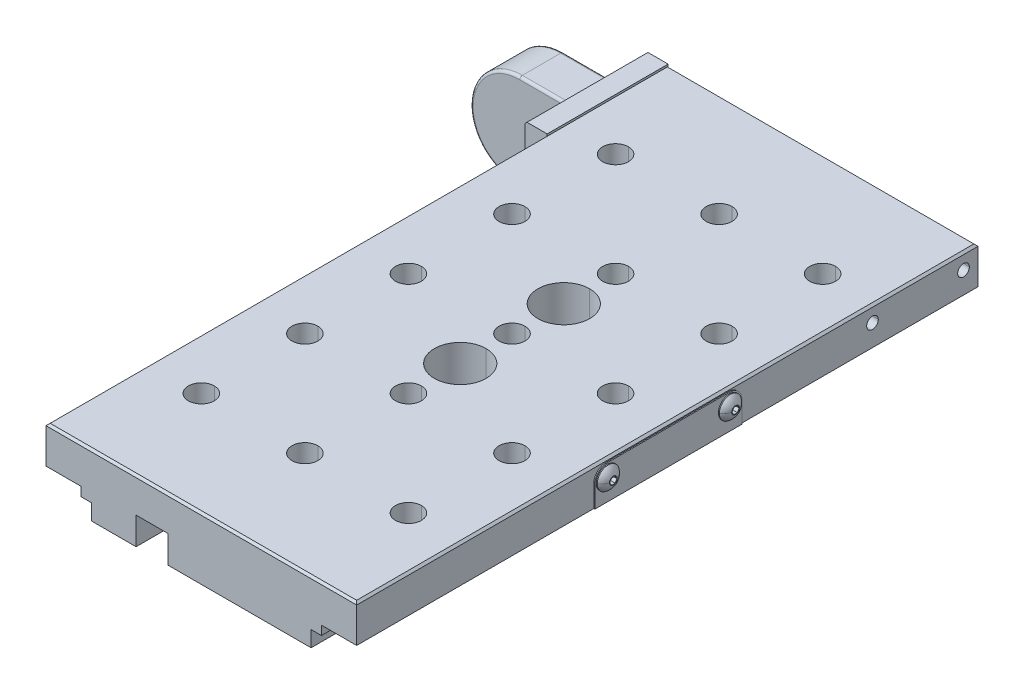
SolidWorks part; units mm, degrees
ref_plane "Plan de face" through (0, 0, 0) normal (0, 0, 1) x (1, 0, 0)
ref_plane "Plan de dessus" through (0, 0, 0) normal (0, 1, 0) x (1, 0, 0)
ref_plane "Plan de droite" through (0, 0, 0) normal (1, 0, 0) x (0, 0, -1)
imported_body "Newport-443 mobile.STEP"
sketch "Esquisse1" plane through (0, 0, 152.4) normal (0, 0, 1) x (1, 0, 0)
  line L1 (-26.924, 9.8186) -> (28.0331, 9.8186)
  line L2 (-26.924, 9.8186) -> (-26.924, 10.2186)
  line L3 (-26.924, 10.2186) -> (28.0331, 10.2186)
  line L4 (28.0331, 9.8186) -> (28.0331, 10.2186)
  dimension "D1" = 0.4
extrude "Enlèv. mat.-Extru.1" cut sketch "Esquisse1" against normal through all
sketch "Esquisse2" plane through (0, 0, 152.4) normal (0, 0, 1) x (1, 0, 0)
  line L1 (-29.464, 15.9004) -> (-39.1704, 15.9004)
  line L2 (-29.464, 15.9004) -> (-29.464, 16.3004)
  line L3 (-29.464, 16.3004) -> (-39.1704, 16.3004)
  line L4 (-39.1704, 15.9004) -> (-39.1704, 16.3004)
  line L5 (29.464, 15.9004) -> (39.7014, 15.9004)
  line L6 (29.464, 15.9004) -> (29.464, 16.3004)
  line L7 (29.464, 16.3004) -> (39.7014, 16.3004)
  line L8 (39.7014, 15.9004) -> (39.7014, 16.3004)
  dimension "D1" = 0.4
extrude "Enlèv. mat.-Extru.2" cut sketch "Esquisse2" against normal through all
